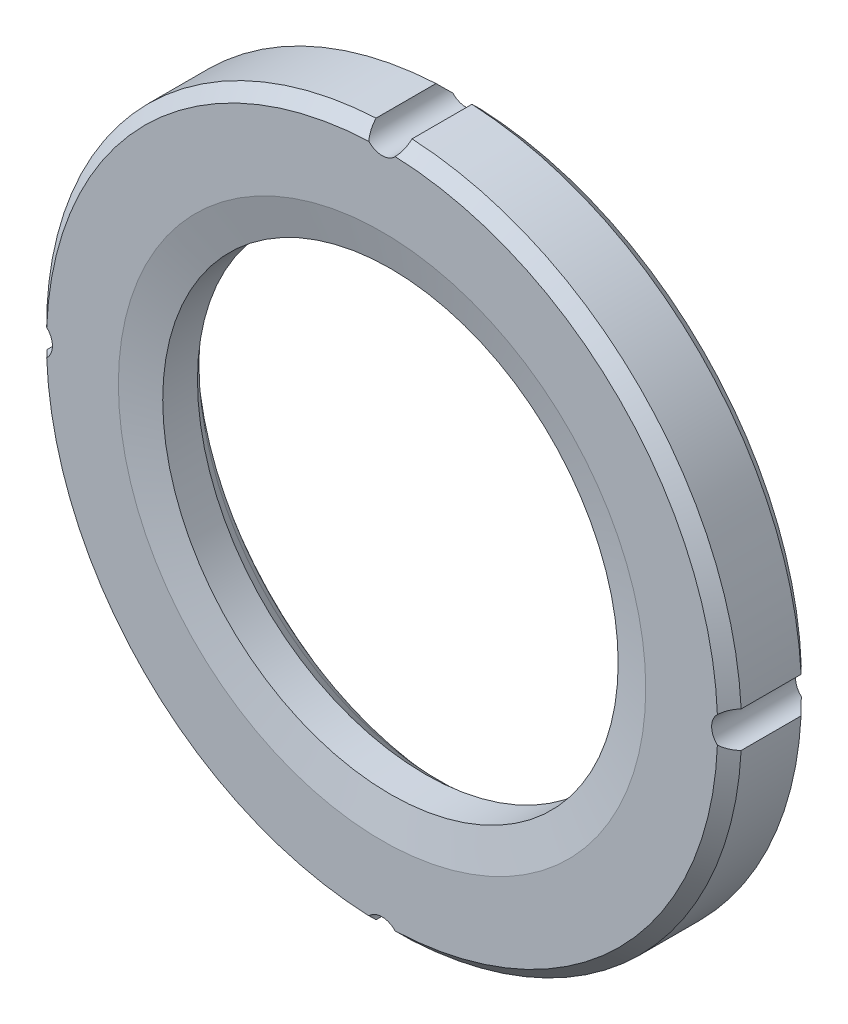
SolidWorks part; units mm, degrees
ref_plane "前基準面" through (0, 0, 0) normal (0, 0, 1) x (1, 0, 0)
ref_plane "上基準面" through (0, 0, 0) normal (0, 1, 0) x (1, 0, 0)
ref_plane "右基準面" through (0, 0, 0) normal (1, 0, 0) x (0, 0, -1)
sketch "草圖3" plane through (0, 0, 0) normal (0, 1, 0) x (1, 0, 0)
  line L0 (0, 31.6513) -> (0, -31.6513) construction
  line L2 (-27.49, 22) -> (27.49, 22) construction
  circle A0 centre (0, 22) radius 31.5 construction
  dimension "D2" = 63
  dimension "D1" = 22
sketch "草圖4" plane through (0, 0, 0) normal (0, 1, 0) x (1, 0, 0)
  line L0 (-30.6625, 0) -> (30.6625, 0) construction
  line L1 (0, 37.9289) -> (0, -37.9289) construction
  line L2 (22.7896, 0) -> (28, 0)
  line L3 (28, 0) -> (29, -1)
  line L4 (29, -1) -> (29, -6)
  line L5 (29, -6) -> (28, -7)
  line L6 (28, -7) -> (22, -7)
  line L7 (22, -7) -> (19, -6.3)
  line L8 (19, -6.3) -> (19, -3.4)
  line L9 (19, -3.4) -> (20.0805, -2.2)
  line L10 (20.0805, -2.2) -> (21.4132, -1)
  line L11 (21.4132, -1) -> (22.7896, 0)
  point P6 (29, -7)
  point P7 (29, 0)
  dimension "D1" = 38
  dimension "D2" = 44
  dimension "D3" = 0.7
  dimension "D4" = 7
  dimension "D5" = 42
  dimension "D6" = 48
  dimension "D7" = 54
  dimension "D8" = 4.8
  dimension "D9" = 6
  dimension "D10" = 3.6
  dimension "D11" = 58
revolve "旋轉1" add sketch "草圖4" angle 360 about L1
sketch "草圖5" plane through (0, 0, 0) normal (0, 0, 1) x (1, 0, 0)
  line L0 (0, 29.9206) -> (0, -29.9206) construction
  line L1 (-30.5468, 0) -> (30.5468, 0) construction
  line L2 (-27.49, 0) -> (27.49, 0) construction
  arc A0 (-1.4995, 28.9612) -> (1.4995, 28.9612) centre (0, 29) ccw
  arc A1 (1.4995, 28.9612) -> (-1.4995, 28.9612) centre (0, 0) ccw
  arc A2 (28.9612, 1.4995) -> (28.9612, -1.4995) centre (29, 0) ccw
  arc A3 (28.9612, -1.4995) -> (28.9612, 1.4995) centre (0, 0) ccw
  arc A4 (1.4995, -28.9612) -> (-1.4995, -28.9612) centre (0, -29) ccw
  arc A5 (-1.4995, -28.9612) -> (1.4995, -28.9612) centre (0, 0) ccw
  arc A6 (-28.9612, -1.4995) -> (-28.9612, 1.4995) centre (-29, 0) ccw
  arc A7 (-28.9612, 1.4995) -> (-28.9612, -1.4995) centre (0, 0) ccw
  circle A8 centre (0, 0) radius 29 construction
  dimension "D1" = 1.5
extrude "除料-伸長2" cut sketch "草圖5" along normal blind 10
